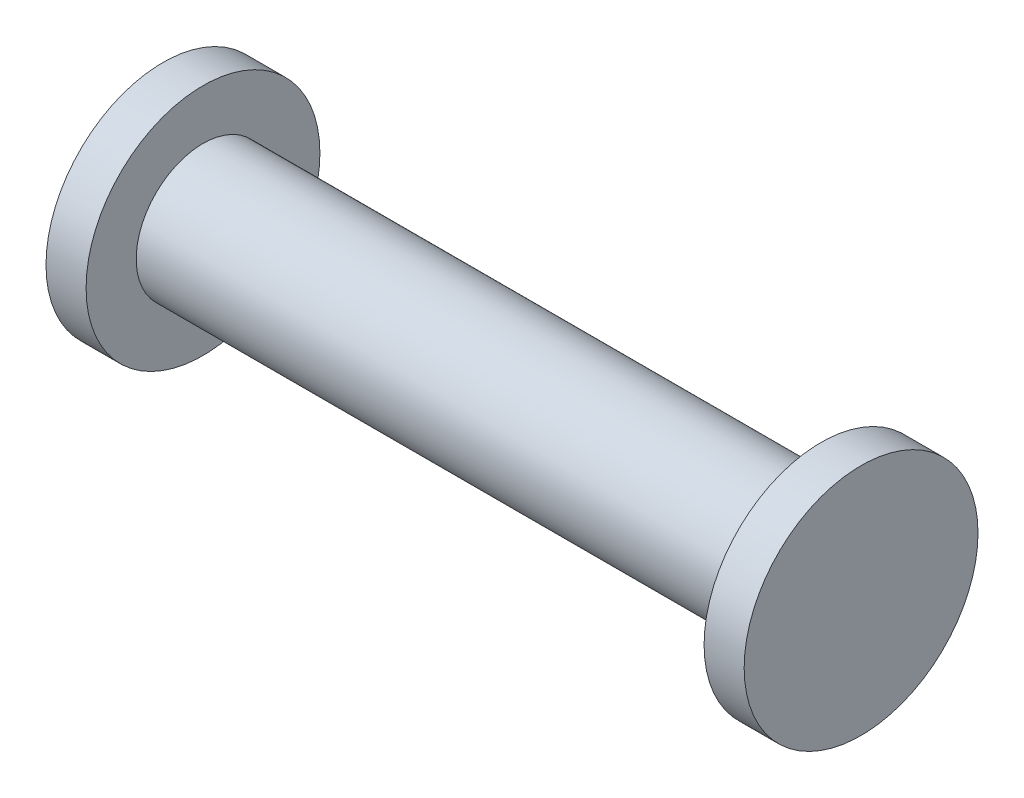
SolidWorks part; units mm, degrees
ref_plane "前视基准面" through (0, 0, 0) normal (0, 0, 1) x (1, 0, 0)
ref_plane "上视基准面" through (0, 0, 0) normal (0, 1, 0) x (1, 0, 0)
ref_plane "右视基准面" through (0, 0, 0) normal (1, 0, 0) x (0, 0, -1)
other "Configuration Table"
sketch "草图1" plane through (0, 0, 0) normal (1, 0, 0) x (0, 0, -1)
  circle A0 centre (0, 0) radius 2
extrude "01_SHAFT_D4" add sketch "草图1" against normal mid plane 18.5
ref_plane "Plane_HEAD_R" through (9.25, 0, 0) normal (1, 0, 0) x (0, 0, -1)
sketch "草图2" plane through (9.25, 0, 0) normal (1, 0, 0) x (0, 0, -1)
  circle A0 centre (0, 0) radius 3.5
extrude "02_HEAD_D7_R" add sketch "草图2" along normal blind 1.2
ref_plane "Plane_HEAD_L" through (-9.25, 0, 0) normal (1, 0, 0) x (0, 0, -1)
sketch "草图3" plane through (-9.25, 0, 0) normal (1, 0, 0) x (0, 0, -1)
  circle A0 centre (0, 0) radius 3.5
extrude "02_HEAD_D7_L" add sketch "草图3" against normal blind 1.2
